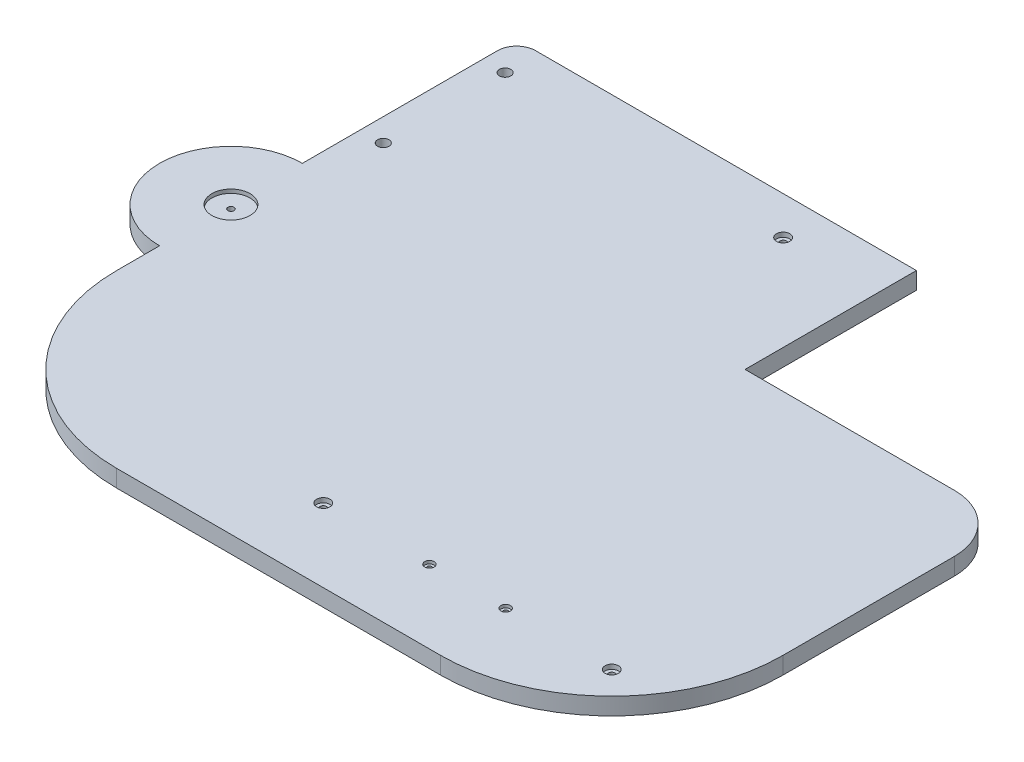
SolidWorks part; units mm, degrees
ref_plane "Front Plane" through (0, 0, 0) normal (0, 0, 1) x (1, 0, 0)
ref_plane "Top Plane" through (0, 0, 0) normal (0, 1, 0) x (1, 0, 0)
ref_plane "Right Plane" through (0, 0, 0) normal (1, 0, 0) x (0, 0, -1)
body saved out of another part "Stock-V1-1"
move or copy body "Body-Move/Copy1" bodies to move or copy 101 copy no rotation origin (18.75, 0, 0) rotation axis (0, 1, 0) rotation angle 180
